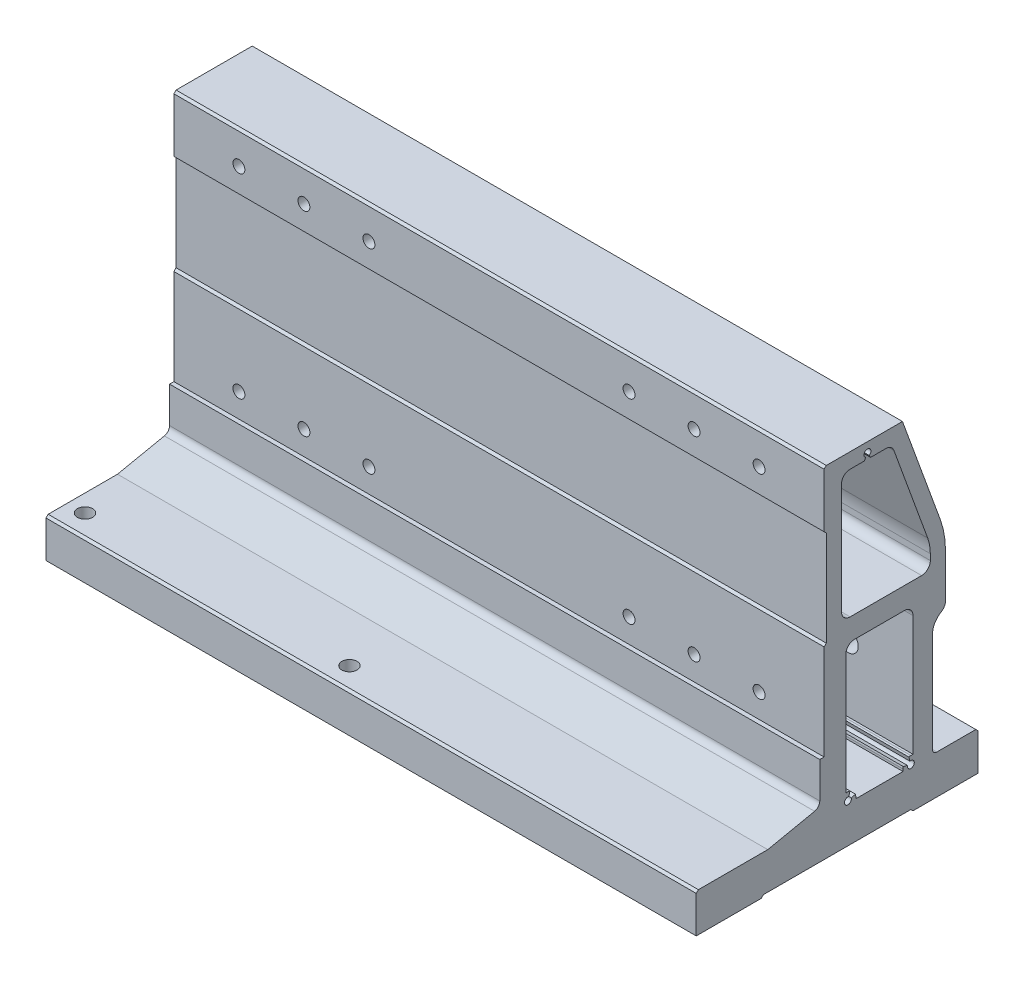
SolidWorks part; units mm, degrees
ref_plane "정면" through (0, 0, 0) normal (0, 0, 1) x (1, 0, 0)
ref_plane "윗면" through (0, 0, 0) normal (0, 1, 0) x (1, 0, 0)
ref_plane "우측면" through (0, 0, 0) normal (1, 0, 0) x (0, 0, -1)
sketch "스케치1" plane through (0, 0, 0) normal (1, 0, 0) x (0, 0, -1)
  line L0 (-5, 157) -> (-6, 156)
  line L1 (-6, 156) -> (-6, 131)
  line L2 (-6, 131) -> (-5, 130)
  line L3 (-5, 130) -> (-5, 86)
  line L4 (-5, 86) -> (-6, 85)
  line L5 (-6, 85) -> (-6, 40.9998)
  line L6 (-6, 40.9998) -> (-8, 40.9998)
  line L7 (-8, 40.9998) -> (-8, 24.4394)
  line L8 (-10.3881, 21.5025) -> (-32, 17)
  line L9 (-32, 17) -> (-64, 17)
  line L10 (-64, 17) -> (-65, 16)
  line L11 (-65, 16) -> (-65, -1)
  line L12 (-65, -1) -> (-35, -1)
  line L13 (-35, -1) -> (-34, 0)
  line L14 (-34, 0) -> (34, 0)
  line L15 (34, 0) -> (35, -1)
  line L16 (35, -1) -> (65, -1)
  line L17 (65, -1) -> (65, 16)
  line L18 (65, 16) -> (64, 17)
  line L19 (64, 17) -> (46, 17)
  line L20 (44, 19) -> (44, 65)
  line L21 (50, 75.3923) -> (50, 95.442)
  line L22 (47.5845, 109.1317) -> (30.149, 157)
  line L23 (30.149, 157) -> (-5, 157)
  line L24 (2, 146) -> (2, 95)
  line L25 (6, 91) -> (39, 91)
  line L26 (43, 95) -> (43, 97.7359)
  line L27 (41.7922, 104.5807) -> (26.2071, 147.369)
  line L28 (22.4487, 150) -> (15.4434, 150)
  line L29 (15.4434, 150) -> (14.8, 151.1144)
  line L30 (13.2, 151.1144) -> (12.5566, 150)
  line L31 (12.5566, 150) -> (6, 150)
  line L32 (8, 81) -> (31, 81)
  line L33 (35, 77) -> (35, 21.6)
  line L34 (35, 21.6) -> (34, 21.6)
  line L35 (33.0683, 21.4773) -> (33.5859, 19.5455)
  line L36 (32.4545, 18.4141) -> (30.5227, 18.9317)
  line L37 (30.4, 18) -> (30.4, 17)
  line L38 (30.4, 17) -> (8.6, 17)
  line L39 (8.6, 17) -> (8.6, 18)
  line L40 (8.4773, 18.9317) -> (6.5455, 18.4141)
  line L41 (5.4141, 19.5455) -> (5.9317, 21.4773)
  line L42 (5, 21.6) -> (4, 21.6)
  line L43 (4, 21.6) -> (4, 77)
  arc A0 (-10.3881, 21.5025) -> (-8, 24.4394) centre (-11, 24.4394) ccw
  arc A1 (44, 19) -> (46, 17) centre (46, 19) ccw
  arc A2 (48, 71.9282) -> (44, 65) centre (52, 65) ccw
  arc A3 (48, 71.9282) -> (50, 75.3923) centre (46, 75.3923) ccw
  arc A4 (50, 95.442) -> (47.5845, 109.1317) centre (10, 95.442) ccw
  arc A5 (2, 95) -> (6, 91) centre (6, 95) ccw
  arc A6 (39, 91) -> (43, 95) centre (39, 95) ccw
  arc A7 (43, 97.7359) -> (41.7922, 104.5807) centre (23, 97.7359) ccw
  arc A8 (26.2071, 147.369) -> (22.4487, 150) centre (22.4487, 146) ccw
  arc A9 (14.8, 151.1144) -> (13.2, 151.1144) centre (14, 152.5) ccw
  arc A10 (6, 150) -> (2, 146) centre (6, 146) ccw
  arc A11 (8, 81) -> (4, 77) centre (8, 77) ccw
  arc A12 (35, 77) -> (31, 81) centre (31, 77) ccw
  arc A13 (34, 21.6) -> (33.0683, 21.4773) centre (34, 18) ccw
  arc A14 (32.4545, 18.4141) -> (33.5859, 19.5455) centre (34, 18) ccw
  arc A15 (30.5227, 18.9317) -> (30.4, 18) centre (34, 18) ccw
  arc A16 (8.6, 18) -> (8.4773, 18.9317) centre (5, 18) ccw
  arc A17 (5.4141, 19.5455) -> (6.5455, 18.4141) centre (5, 18) ccw
  arc A18 (5.9317, 21.4773) -> (5, 21.6) centre (5, 18) ccw
extrude "보스-돌출1" add sketch "스케치1" along normal mid plane 300
hole_wizard "M5 소켓 머리 캡 나사용 카운터보어1" positions "스케치2" profile "스케치3" counterbore size "M5" standard "KS"
sketch "스케치2" plane through (0, 0, -50) normal (0, 0, -1) x (-1, 0, 0)
  line L0 (-150, -1) -> (150, -1) construction
  line L1 (-150, 109.1317) -> (-150, 157) construction
  point P0 (-120, 142)
  point P2 (-90, 142)
  point P4 (-60, 142)
  point P6 (-120, 52)
  point P8 (-90, 52)
  point P10 (-60, 52)
  dimension "D1" = 90
  dimension "D2" = 53
  dimension "D3" = 30
  dimension "D4" = 30
  dimension "D5" = 30
sketch "스케치3" plane through (120, 142, -50) normal (1, 0, 0) x (0, 1, 0)
  line L0 (0, 0) -> (0, 115)
  line L1 (0, 115) -> (2.75, 115)
  line L3 (2.75, 115) -> (2.75, 49)
  line L4 (2.75, 49) -> (4.75, 49)
  line L5 (4.75, 49) -> (4.75, 0)
  line L7 (4.75, 0) -> (0, 0)
  line L11 (0, -6.35) -> (0, 107.95) construction
  dimension "관통 구멍 지름" = 5.5
  dimension "관통 구멍 깊이" = 115
  dimension "카운터보어 지름" = 9.5
  dimension "카운터보어 깊이" = 49
pattern_linear "선형 패턴1" count 2 spacing 180 along (-1, 0, 0) of "M5 소켓 머리 캡 나사용 카운터보어1"
hole_wizard "M5 나사 구멍1" positions "스케치4" profile "스케치5" tap size "M5" standard "ISO"
sketch "스케치4" plane through (-150, 0, 0) normal (-1, 0, 0) x (0, 0, 1)
  line L0 (-65, -1) -> (-65, 16) construction
  line L1 (-35, -1) -> (-65, -1) construction
  point P0 (-45, 8)
  point P2 (-9, 8)
  dimension "D1" = 20
  dimension "D2" = 36
  dimension "D3" = 9
sketch "스케치5" plane through (-150, 8, -45) normal (0, 1, 0) x (0, 0, 1)
  line L0 (0, 0) -> (0, 13.2618)
  line L1 (0, 13.2618) -> (2.1, 12)
  line L2 (2.1, 12) -> (2.1, 0.425)
  line L3 (2.1, 0.425) -> (2.525, 0)
  line L5 (2.525, 0) -> (0, 0)
  line L6 (-2.1, 0.425) -> (-2.525, 0) construction
  line L10 (0, 13.2618) -> (-2.1, 12) construction
  line L11 (0, -6.35) -> (0, 107.95) construction
  dimension "탭 드릴 지름" = 4.2
  dimension "탭 드릴 깊이" = 12
  dimension "표면 카운터싱크 지름" = 5.05
  dimension "표면 카운터싱크 각도" = 90
  dimension "드릴 각도" = 118
hole_wizard "Ø5.0mm 맞춤핀 구멍1" positions "스케치6" profile "스케치7" hole size "Ø5.0" standard "ISO"
sketch "스케치6" plane through (0, 0, 0) normal (0, -1, 0) x (-1, 0, 0)
  line L0 (0, 0) -> (171.941, 0) construction
  line L1 (150, -34) -> (150, 34) construction
  point P5 (142, 0)
  point P7 (20, 0)
  dimension "D1" = 122
  dimension "D2" = 8
sketch "스케치7" plane through (-20, 0, 0) normal (1, 0, 0) x (0, 0, -1)
  line L0 (0, 0) -> (0, 11.5022)
  line L1 (0, 11.5022) -> (2.5, 10)
  line L2 (2.5, 10) -> (2.5, 0)
  line L5 (2.5, 0) -> (0, 0)
  line L10 (0, 11.5022) -> (-2.5, 10) construction
  line L11 (0, -6.35) -> (0, 107.95) construction
  dimension "구멍 지름" = 5
  dimension "구멍 깊이" = 10
  dimension "드릴 각도" = 118
hole_wizard "Ø7.0 (7) 지름 구멍1" positions "스케치8" profile "스케치9" hole size "Ø7.0" standard "ISO"
sketch "스케치8" plane through (0, -1, 0) normal (0, -1, 0) x (-1, 0, 0)
  line L0 (150, -65) -> (150, -35) construction
  line L1 (-150, -65) -> (150, -65) construction
  point P0 (142, -55)
  point P2 (20, -55)
  point P4 (142, 55)
  point P6 (20, 55)
  dimension "D1" = 8
  dimension "D2" = 122
  dimension "D3" = 10
  dimension "D4" = 110
sketch "스케치9" plane through (-142, -1, 55) normal (1, 0, 0) x (0, 0, -1)
  line L0 (0, 0) -> (0, 158)
  line L1 (0, 158) -> (3.5, 158)
  line L2 (3.5, 158) -> (3.5, 0)
  line L5 (3.5, 0) -> (0, 0)
  line L11 (0, -6.35) -> (0, 107.95) construction
  dimension "관통 구멍 지름" = 7
  dimension "관통 구멍 깊이" = 158
